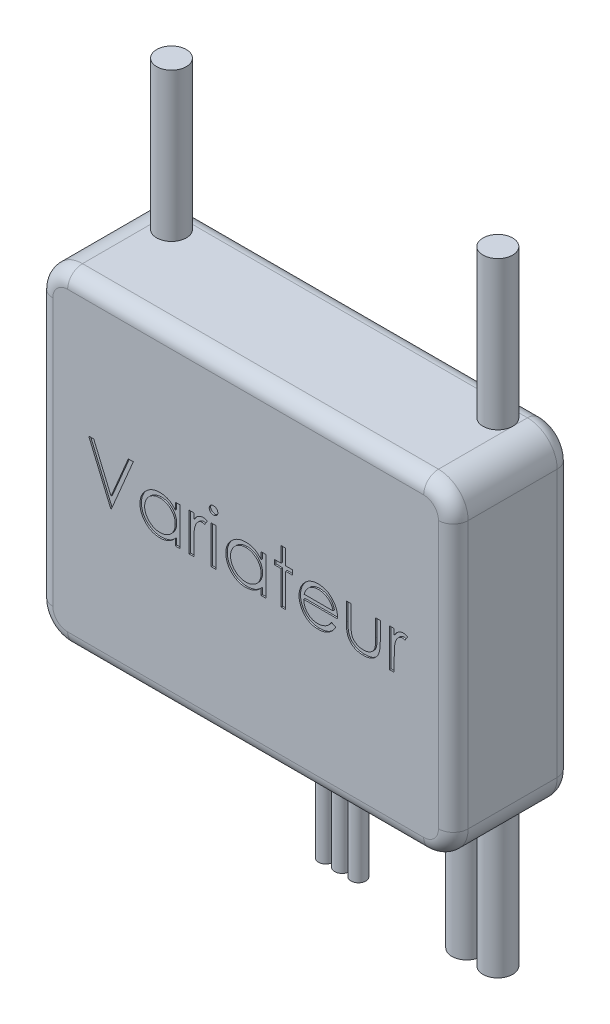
SolidWorks part; units mm, degrees
ref_plane "Plan de face" through (0, 0, 0) normal (0, 0, 1) x (1, 0, 0)
ref_plane "Plan de dessus" through (0, 0, 0) normal (0, 1, 0) x (1, 0, 0)
ref_plane "Plan de droite" through (0, 0, 0) normal (1, 0, 0) x (0, 0, -1)
sketch "Esquisse1" plane through (0, 0, 0) normal (0, 0, 1) x (1, 0, 0)
  line L1 (-12, 11) -> (12, 11)
  line L2 (-14, 9) -> (-14, -9)
  line L3 (-12, -11) -> (12, -11)
  line L4 (14, 9) -> (14, -9)
  arc A0 (-12, 11) -> (-14, 9) centre (-12, 9) ccw
  arc A1 (12, 11) -> (14, 9) centre (12, 9) cw
  arc A2 (12, -11) -> (14, -9) centre (12, -9) ccw
  arc A3 (-14, -9) -> (-12, -11) centre (-12, -9) ccw
  point P6 (-14, 11)
  point P9 (14, 11)
  point P12 (14, -11)
  dimension "D5" = 2
  dimension "D1" = 28
  dimension "D2" = 22
  dimension "D3" = 11
  dimension "D4" = 14
extrude "Extrusion1" add sketch "Esquisse1" along normal blind 8
fillet "Congé1" radius 1 16 edges at (-14, 0, 0) (-13.4142, -10.4142, 0) (0, -11, 0) (13.4142, -10.4142, 0) (14, 0, 0) (13.4142, 10.4142, 0) (0, 11, 0) (-13.4142, 10.4142, 0) (0, 11, 8) (13.4142, 10.4142, 8) (14, 0, 8) (13.4142, -10.4142, 8) (0, -11, 8) (-13.4142, -10.4142, 8) (-14, 0, 8) (-13.4142, 10.4142, 8)
sketch "Esquisse2" plane through (0, 0, 8) normal (0, 0, 1) x (1, 0, 0)
  text T0 "Variateur"
extrude "Enlèv. mat.-Extru.1" cut sketch "Esquisse2" against normal blind 0.1
sketch "Esquisse3" plane through (0, -11, 0) normal (0, -1, 0) x (1, 0, 0)
  line L1 (-12, 1) -> (12, 1) construction
  line L2 (12, 7) -> (12, 1) construction
  circle A0 centre (11, 2) radius 1
  circle A1 centre (8.9, 2) radius 1
  circle A2 centre (-1.1, 1.5) radius 0.5
  circle A3 centre (0, 1.5) radius 0.5
  circle A4 centre (1.1, 1.5) radius 0.5
  dimension "D1" = 2
  dimension "D2" = 2.1
  dimension "D3" = 1
  dimension "D4" = 1.1
  dimension "D5" = 1.1
extrude "Extrusion2" add sketch "Esquisse3" along normal blind 10
sketch "Esquisse4" plane through (0, 11, 0) normal (0, 1, 0) x (-1, 0, 0)
  line L0 (-12, 1) -> (12, 1) construction
  line L1 (-12, 7) -> (-12, 1) construction
  line L2 (12, 7) -> (12, 1) construction
  circle A0 centre (-11, 2) radius 1
  circle A1 centre (11, 2) radius 1
  dimension "D1" = 2
extrude "Extrusion3" add sketch "Esquisse4" along normal blind 10
